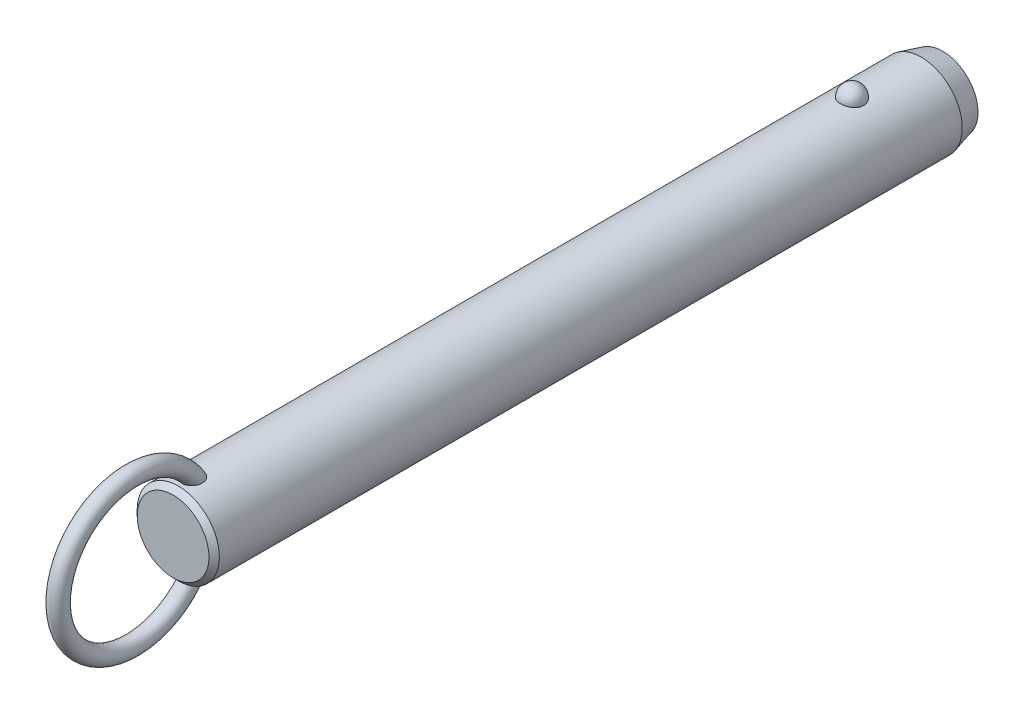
SolidWorks part; units mm, degrees
ref_plane "Front Plane" through (0, 0, 0) normal (0, 0, 1) x (1, 0, 0)
ref_plane "Top Plane" through (0, 0, 0) normal (0, 1, 0) x (1, 0, 0)
ref_plane "Right Plane" through (0, 0, 0) normal (1, 0, 0) x (0, 0, -1)
sketch "Sketch2" plane through (0, 0, 0) normal (0, 0, 1) x (1, 0, 0)
  circle A0 centre (0, 0) radius 9.5
  point P3 (0, 9.5)
  dimension "D1" = 19
extrude "Boss-Extrude1" add sketch "Sketch2" along normal blind 144.8
sketch "Sketch3" plane through (0, 0, 0) normal (0, 0, -1) x (-1, 0, 0)
  circle A0 centre (0, 0) radius 9.5
  dimension "D1" = 19
extrude "Boss-Extrude2" add sketch "Sketch3" along normal blind 23.7
chamfer "Chamfer1" distance 5 angle 15 1 edges at (-9.5, 0, -23.7)
sketch "Sketch12" plane through (0, 0, 0) normal (1, 0, 0) x (0, 0, -1)
  line L0 (-144.8, 9.5) -> (-144.8, -9.5) construction
  point P0 (-144.8, 0)
sketch "Sketch13" plane through (0, 0, 0) normal (1, 0, 0) x (0, 0, -1)
  circle A0 centre (-163.85, 0) radius 19.05
  point P2 (-144.8, 0)
  dimension "D1" = 38.1
sketch "Sketch14" plane through (0, 0, 0) normal (0, 1, 0) x (1, 0, 0)
  circle A0 centre (0, -146.8) radius 2
  point P2 (0, -144.8)
  dimension "D1" = 4
sweep "Sweep1" add profiles "Sketch14" path "Sketch13"
sketch "Sketch15" plane through (0, 0, 144.8) normal (0, 0, 1) x (1, 0, 0)
  circle A0 centre (0, 0) radius 9.5
  dimension "D1" = 19
extrude "Boss-Extrude3" add sketch "Sketch15" along normal blind 9.52
chamfer "Chamfer2" distance 1.2 angle 45 1 edges at (9.5, 0, 154.32)
sketch "Sketch18" plane through (0, 0, 0) normal (1, 0, 0) x (0, 0, -1)
  line L0 (18.7, 9.5) -> (-147.3378, 9.5) construction
  line L1 (2.7, 12.2) -> (2.7, 6.8)
  line L2 (-147.3378, -9.5) -> (18.7, -9.5) construction
  arc A0 (2.7, 12.2) -> (2.7, 6.8) centre (2.7, 9.5) ccw
  point P4 (0, 9.5)
  dimension "D1" = 21.7
revolve "Revolve1" add sketch "Sketch18" angle 360 about L1
